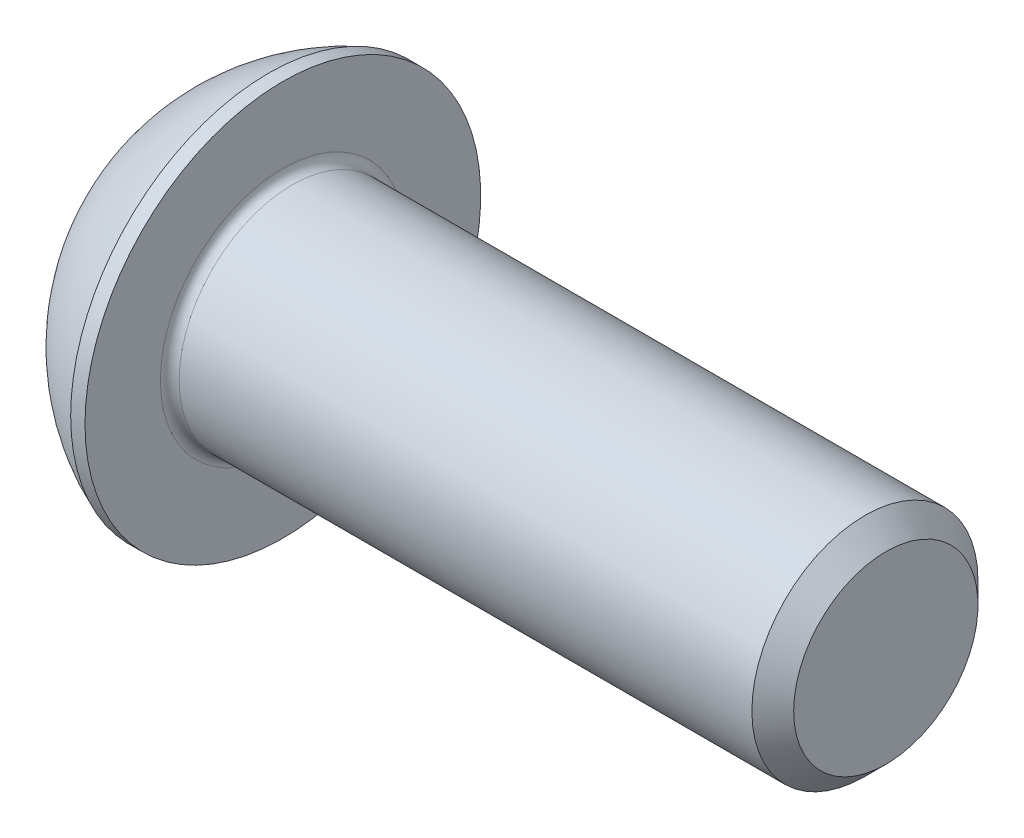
SolidWorks part; units mm, degrees
ref_plane "Plane1" through (0, 0, 0) normal (0, 0, 1) x (1, 0, 0)
ref_plane "Plane2" through (0, 0, 0) normal (0, 1, 0) x (1, 0, 0)
ref_plane "Plane3" through (0, 0, 0) normal (1, 0, 0) x (0, 0, -1)
sketch "BodySke" plane through (0, 0, 0) normal (0, 0, 1) x (1, 0, 0)
  line L0 (19.3, 0) -> (19.3, 2.4455)
  line L1 (18.7455, 3) -> (3.3, 3)
  line L2 (3.3, 3) -> (3.3, 5.25)
  line L3 (3.3, 5.25) -> (2.92, 5.25)
  line L4 (0, 0) -> (101.6, 0) construction
  line L5 (3.3, -5.25) -> (2.92, -5.25) construction
  line L6 (55.6768, -3) -> (3.3, -3) construction
  line L7 (19.3, 0) -> (0, 0)
  line L8 (0, 2.625) -> (0, -2.625) construction
  line L9 (0, 0) -> (0, 2.625)
  line L10 (19.3, 2.4455) -> (18.7455, 3)
  line L11 (19.3, -2.4455) -> (18.7455, -3) construction
  line L12 (4.3, 9.525) -> (4.3, -3) construction
  line L13 (3.3, 9.525) -> (3.3, -3) construction
  arc A1 (0, 2.625) -> (2.92, 5.25) centre (4.9997, 0) cw
  dimension "D1" = 5.25
  dimension "Diameter" = 6
  dimension "Length" = 16
  dimension "Head_dia" = 10.5
  dimension "Head_ht" = 3.3
  dimension "Head_side_ht" = 0.38
  dimension "Minor_dia" = 4.891
  dimension "Body_ch_ang" = 45
  dimension "Advance" = 1
  dimension "Thread_nom" = 16
revolve "BaseBody" add sketch "BodySke" angle 360 about L4
fillet "Fillet1" radius 0.25
sketch "Sketch2" plane through (0, 0, 0) normal (0, 0, 1) x (1, 0, 0)
  line L0 (0, 2) -> (2.08, 2)
  line L1 (2.08, 2) -> (3.2347, 0)
  line L3 (3.2347, 0) -> (0, 0)
  line L4 (0, 0) -> (0, 2)
  line L5 (0, -2) -> (2.08, -2) construction
  line L6 (0, 0) -> (47.625, 0) construction
  dimension "D2" = 60
  dimension "PreBroach_depth" = 2.08
  dimension "PreBroach_dia" = 4
revolve "PreBroach" cut sketch "Sketch2" angle 360 about L6
sketch "Sketch3" plane through (0, 0, 0) normal (1, 0, 0) x (0, 0, -1)
  line L0 (-2, -1.1547) -> (-2, 1.1547)
  line L1 (-2, 1.1547) -> (0, 2.3094)
  line L2 (0, 2.3094) -> (2, 1.1547)
  line L3 (2, 1.1547) -> (2, -1.1547)
  line L4 (2, -1.1547) -> (0, -2.3094)
  line L5 (0, -2.3094) -> (-2, -1.1547)
  dimension "D1" = 2
  dimension "D2" = 2
  dimension "D3" = 4
  dimension "Hex_size" = 4
extrude "Hex" cut sketch "Sketch3" along normal blind 2.08
sketch "ThdSchSke" plane through (0, 0, 0) normal (0, 0, 1) x (1, 0, 0)
  line L0 (5.3, -2.4455) -> (4.9117, -3)
  line L1 (5.3, -2.4455) -> (5.6883, -3)
  line L2 (5.6883, -3) -> (5.6883, -3.75)
  line L3 (-3.175, 0) -> (5.1513, 0) construction
  line L4 (0, 1.1547) -> (0, 2.3094) construction
  line L5 (5.6883, -3.75) -> (4.9117, -3.75)
  line L6 (4.9117, -3.75) -> (4.9117, -3)
  dimension "Thread_minor" = 4.891
  dimension "Diameter" = 6
  dimension "Start" = 5.3
  dimension "SideAngle" = 55
  dimension "VeeAngle" = 70
  dimension "Overcut" = 7.5
revolve "ThreadSchematic" [suppressed] cut sketch "ThdSchSke" angle 360 about L3
pattern_linear "ThdSchPat" [suppressed]
equation "\"D1@BodySke\" = \"Head_dia@BodySke\" * .5"
equation "\"Thread_minor@ThreadCosmetic\" = \"Minor_dia@BodySke\""
equation "\"D1@Sketch3\" = \"Hex_size@Sketch3\" / 2"
equation "\"D2@Sketch3\" = \"D1@Sketch3\""
equation "\"D3@Sketch3\" = \"Hex_size@Sketch3\""
equation "\"Thread_length@ThreadCosmetic\" = ((sgn( (\"Length@BodySke\" - \"Advance@BodySke\" * 2.0) - \"Thread_nom@BodySke\" )-1)*( (\"Length@BodySke\" - \"Advance@BodySke\" * 2.0) - \"Thread_nom@BodySke\" ))/-2+ \"Thread_no"
equation "\"Thread_minor@ThdSchSke\" = \"Minor_dia@BodySke\""
equation "\"Diameter@ThdSchSke\" = \"Diameter@BodySke\""
equation "\"Overcut@ThdSchSke\" = \"Diameter@BodySke\" * 1.25"
equation "\"Start@ThdSchSke\" = \"Head_ht@BodySke\" + \"Length@BodySke\" - \"Thread_length@ThreadCosmetic\"  '---Non-countersunk---"
equation "\"Num_threads@ThdSchPat\" = int( \"Thread_length@ThreadCosmetic\" / \"Advance@BodySke\" + 0.999 )  + 1"
equation "\"Advance@ThdSchPat\" = \"Thread_length@ThreadCosmetic\" /  (\"Num_threads@ThdSchPat\" - 1) 'relax it"
equation "\"Num_threads@ThdSchPat\" = \"Num_threads@ThdSchPat\" - sgn( \"Num_threads@ThdSchPat\" - 1) '---chamfered tips only---"
